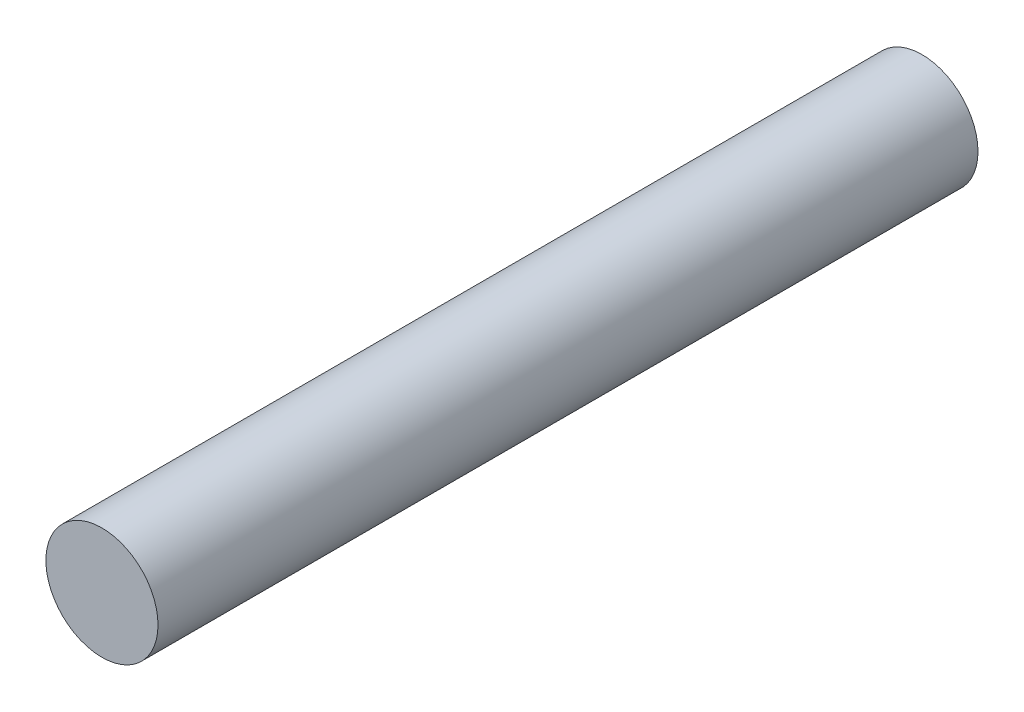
SolidWorks part; units mm, degrees
ref_plane "Front Plane" through (0, 0, 0) normal (0, 0, 1) x (1, 0, 0)
ref_plane "Top Plane" through (0, 0, 0) normal (0, 1, 0) x (1, 0, 0)
ref_plane "Right Plane" through (0, 0, 0) normal (1, 0, 0) x (0, 0, -1)
other "Configuration Table"
sketch "Sketch1" plane through (0, 0, 0) normal (0, 0, 1) x (1, 0, 0)
  circle A0 centre (0, 0) radius 2.3876
  dimension "D1" = 4.7752
extrude "Boss-Extrude1" add sketch "Sketch1" along normal mid plane 34.925
